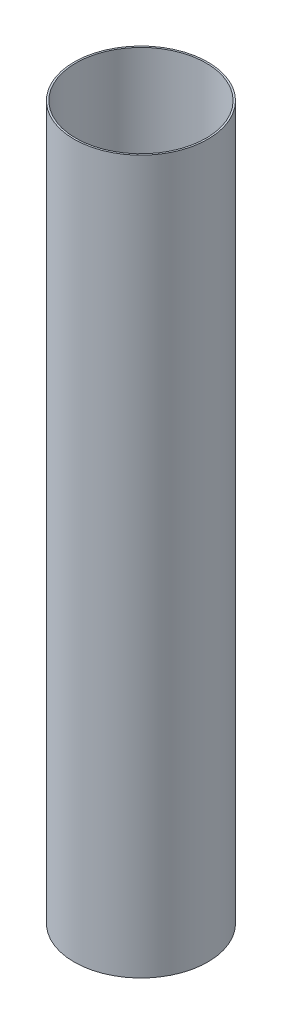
SolidWorks part; units mm, degrees
ref_plane "Front Plane" through (0, 0, 0) normal (0, 0, 1) x (1, 0, 0)
ref_plane "Top Plane" through (0, 0, 0) normal (0, 1, 0) x (1, 0, 0)
ref_plane "Right Plane" through (0, 0, 0) normal (1, 0, 0) x (0, 0, -1)
sketch "Sketch2" plane through (0, 0, 0) normal (0, 1, 0) x (1, 0, 0)
  circle A0 centre (0, 0) radius 69.85
  circle A1 centre (0, 0) radius 68.072
  dimension "D1" = 139.7
  dimension "D2" = 136.144
extrude "Boss-Extrude1" add sketch "Sketch2" along normal blind 744.22
